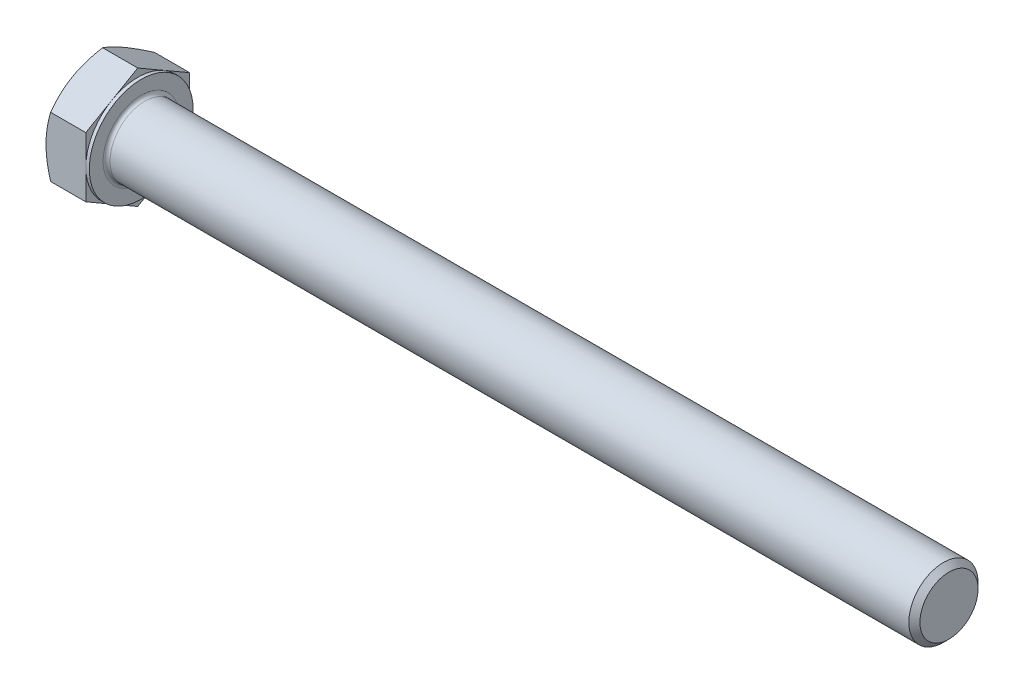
SolidWorks part; units mm, degrees
extrude "BaseHead" add sketch "Sketch1" along normal blind 7.5
sketch "Sketch1" plane through (0, 0, 0) normal (1, 0, 0) x (0, 0, -1)
  line L0 (9, 5.1962) -> (9, -5.1962)
  line L1 (-9, 5.1962) -> (-9, -5.1962)
  line L2 (9, -5.1962) -> (0, -10.3923)
  line L3 (0, -10.3923) -> (-9, -5.1962)
  line L4 (9, 5.1962) -> (0, 10.3923)
  line L5 (0, 10.3923) -> (-9, 5.1962)
revolve "HeadChamfer" cut sketch "Sketch3" angle 360 about L6
sketch "Sketch3" plane through (0, 0, 0) normal (0, 0, 1) x (1, 0, 0)
  line L0 (0, 9) -> (3.6906, 15.3923)
  line L1 (0, 10.3923) -> (0, 5.1962) construction
  line L2 (3.6906, 15.3923) -> (3.6906, 20.3923)
  line L3 (3.6906, 20.3923) -> (-10, 20.3923)
  line L4 (-10, 20.3923) -> (-10, 9)
  line L5 (-10, 9) -> (0, 9)
  line L6 (0, 0) -> (99.06, 0) construction
  line L7 (7.5, 10.3923) -> (0, 10.3923) construction
ref_plane "Plane1" through (0, 0, 0) normal (0, 0, 1) x (1, 0, 0)
ref_plane "Plane2" through (0, 0, 0) normal (0, 1, 0) x (1, 0, 0)
ref_plane "Plane3" through (0, 0, 0) normal (1, 0, 0) x (0, 0, -1)
sketch "BodySke" plane through (0, 0, 0) normal (0, 0, 1) x (1, 0, 0)
  line L0 (0, 5.1962) -> (0, -5.1962) construction
  line L1 (0, 0) -> (147.5, 0)
  line L2 (0, 0) -> (0, 6)
  line L3 (0, 6) -> (146.536, 6)
  line L4 (147.5, 0) -> (147.5, 5.036)
  line L5 (7.5, 10.3923) -> (7.5, 5.1962) construction
  line L6 (147.5, 5.036) -> (146.536, 6)
  line L7 (0, 0) -> (96.52, 0) construction
  line L8 (147.5, -5.036) -> (146.536, -6) construction
  line L9 (0, -6) -> (146.536, -6) construction
  line L10 (9.25, 15.24) -> (9.25, -1.27) construction
  line L11 (117.5, 15.24) -> (117.5, -1.27) construction
  line L12 (7.5, 5.1962) -> (7.5, -5.1962) construction
revolve "BaseBody" add sketch "BodySke"
fillet "HeadFillet" radius 0.6 1 edges at (7.5, 0, -6)
sketch "Sketch4" plane through (0, 0, 0) normal (0, 0, 1) x (1, 0, 0)
  line L1 (7.5, 10.3923) -> (7.5, 5.1962) construction
  line L2 (7.5, 9) -> (6.9, 9)
  line L3 (7.5, 9) -> (7.5, 20.3923)
  line L4 (7.5, 20.3923) -> (6.9, 20.3923)
  line L5 (0, 0) -> (95.25, 0) construction
  line L6 (0, 0) -> (96.52, 0) construction
  line L7 (6.9, 9) -> (6.9, 20.3923)
  line L8 (7.5, 10.3923) -> (0.8038, 10.3923) construction
revolve "BearingFace" cut sketch "Sketch4" angle 360 about L5
sketch "ThdSchSke" plane through (0, 0, 0) normal (0, 0, 1) x (1, 0, 0)
  line L0 (117.5, -5.036) -> (116.825, -6)
  line L1 (117.5, -5.036) -> (118.175, -6)
  line L2 (118.175, -6) -> (118.175, -7.5)
  line L3 (-3.175, 0) -> (5.1513, 0) construction
  line L5 (118.175, -7.5) -> (116.825, -7.5)
  line L6 (116.825, -7.5) -> (116.825, -6)
revolve "ThreadSchematic" [suppressed] cut sketch "ThdSchSke" angle 360 about L3
pattern_linear "ThdSchPat" [suppressed]
equation "\"D3@Sketch1\" = \"Width_flats@Sketch1\" / 2"
equation "\"D4@Sketch1\" = \"D3@Sketch1\""
equation "\"D5@Sketch1\" = \"D4@Sketch1\""
equation "\"Thread_minor@ThreadCosmetic\" = \"Minor_dia@BodySke\""
equation "\"D1@Sketch3\" = \"Width_flats@Sketch1\" / 2"
equation "\"D1@Sketch4\" = \"Width_flats@Sketch1\""
equation "\"Thread_length@ThreadCosmetic\" = ((sgn( (\"Length@BodySke\" - \"Advance@BodySke\" ) - \"Thread_nom@BodySke\" )-1)*( (\"Length@BodySke\" - \"Advance@BodySke\" ) - \"Thread_nom@BodySke\" ))/-2+ \"Thread_nom@BodySke\""
equation "\"Thread_minor@ThdSchSke\" = \"Minor_dia@BodySke\""
equation "\"Diameter@ThdSchSke\" = \"Diameter@BodySke\""
equation "\"Overcut@ThdSchSke\" = \"Diameter@BodySke\" * 1.25"
equation "\"Start@ThdSchSke\" = \"Head_ht@BaseHead\" + \"Length@BodySke\" - \"Thread_length@ThreadCosmetic\"  '---Non-countersunk---"
equation "\"Num_threads@ThdSchPat\" = int( \"Thread_length@ThreadCosmetic\" / \"Advance@BodySke\" + 0.999 )  + 1"
equation "\"Advance@ThdSchPat\" = \"Thread_length@ThreadCosmetic\" /  (\"Num_threads@ThdSchPat\" - 1) 'relax it"
equation "\"Num_threads@ThdSchPat\" = \"Num_threads@ThdSchPat\" - sgn( \"Num_threads@ThdSchPat\" - 1) '---chamfered tips only---"
